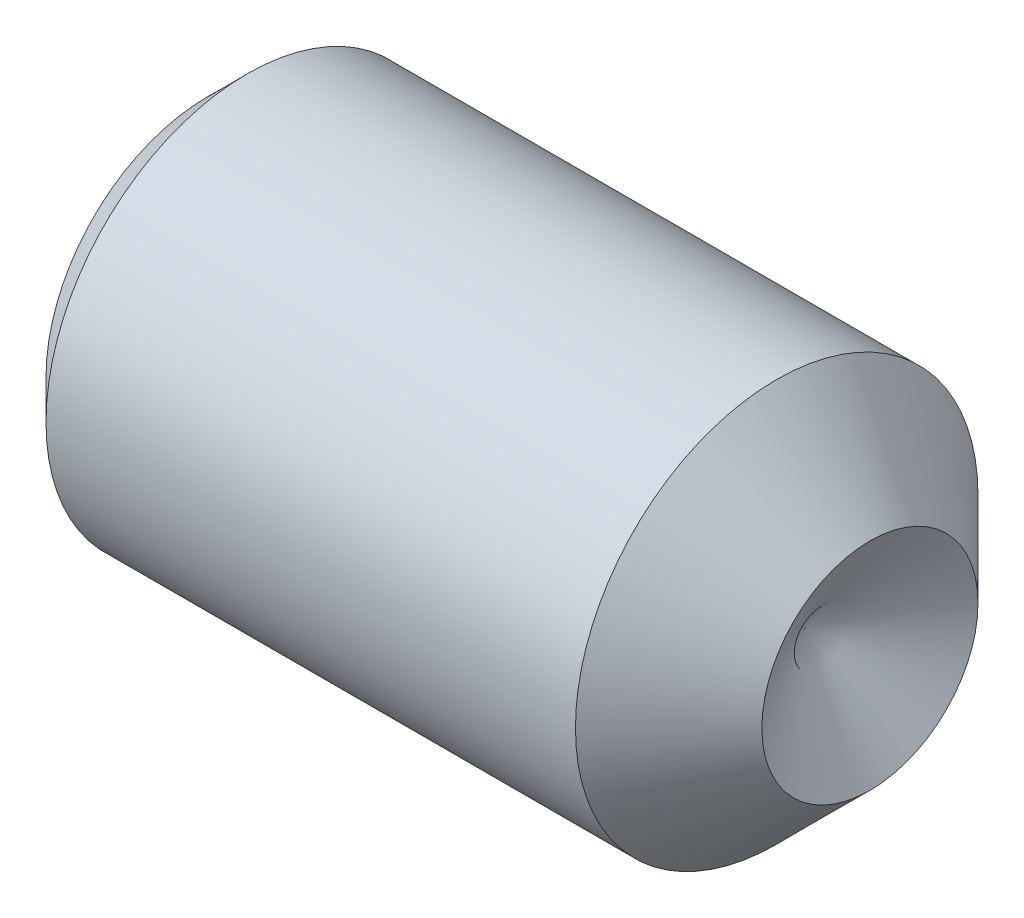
SolidWorks part; units mm, degrees
ref_plane "Plane1" through (0, 0, 0) normal (0, 0, 1) x (1, 0, 0)
ref_plane "Plane2" through (0, 0, 0) normal (0, 1, 0) x (1, 0, 0)
ref_plane "Plane3" through (0, 0, 0) normal (1, 0, 0) x (0, 0, -1)
revolve "BaseBody" add sketch "BodySke" angle 360 about L5
sketch "BodySke" plane through (0, 0, 0) normal (0, 0, 1) x (1, 0, 0)
  line L0 (0, 0) -> (0, 1.9406)
  line L1 (0, 1.9406) -> (0.4724, 2.413)
  line L2 (0.4724, 2.413) -> (6.8199, 2.413)
  line L3 (6.8199, 2.413) -> (7.9375, 1.2954)
  line L4 (7.1591, 0) -> (0, 0)
  line L5 (-12.7, 0) -> (88.9, 0) construction
  line L6 (7.1591, 0) -> (7.9375, 1.2954)
  line L7 (7.9375, 1.2954) -> (7.9375, 10.8204) construction
  line L8 (0, -1.9406) -> (0.4724, -2.413) construction
  line L9 (7.1591, 0) -> (7.9375, -1.2954) construction
  line L10 (6.8199, -2.413) -> (7.9375, -1.2954) construction
  line L11 (0.7925, 15.875) -> (0.7925, -3.175) construction
  dimension "Length" = 7.9375
  dimension "Diameter" = 4.826
  dimension "Drive_ch_ang" = 45
  dimension "Minor_dia" = 3.8811
  dimension "Cup_nose_ang" = 45
  dimension "Cup_ang" = 118
  dimension "Cup_dia" = 2.5908
  dimension "Advance" = 0.7925
sketch "Sketch2" plane through (0, 0, 0) normal (-1, 0, 0) x (0, 0, 1)
  line L0 (0.687, 1.19) -> (-0.687, 1.19)
  line L1 (-0.687, 1.19) -> (-1.3741, 0)
  line L2 (0.687, 1.19) -> (1.3741, 0)
  line L3 (0.687, -1.19) -> (1.3741, 0)
  line L4 (0.687, -1.19) -> (-0.687, -1.19)
  line L5 (-0.687, -1.19) -> (-1.3741, 0)
  dimension "Hex_size" = 2.38
  dimension "D2" = 1.19
  dimension "D3" = 1.19
extrude "Hex" cut sketch "Sketch2" against normal blind 2.54
sketch "Sketch4" plane through (0, 4.7709, -0.5249) normal (-1, 0, 0) x (0, 0, 1)
  line L0 (0.5249, -4.7709) -> (1.9854, -4.7709)
  line L1 (0.5249, -4.7709) -> (6.6732, -1.2211) construction
  line L2 (0.5249, -4.7709) -> (1.2551, -3.506)
  line L3 (1.7258, -4.4441) -> (1.9182, -4.333)
  line L4 (1.4083, -3.8942) -> (1.6007, -3.7831)
  arc A0 (1.7258, -4.4441) -> (1.4083, -3.8942) centre (0.5249, -4.7709) ccw
  arc A1 (1.9854, -4.7709) -> (1.9182, -4.333) centre (0.5249, -4.7709) ccw
  arc A2 (1.2551, -3.506) -> (1.6007, -3.7831) centre (0.5249, -4.7709) cw
  circle A3 centre (0.5249, -4.7709) radius 1.2446 construction
  circle A4 centre (0.5249, -4.7709) radius 1.4605 construction
  dimension "D1" = 30
  dimension "Spline_n_dim" = 2.4892
  dimension "Spline_m_dim" = 2.921
  dimension "Spline_a_dim" = 60
  dimension "D3" = 0.3175
  dimension "Spline_p_dim" = 0.635
extrude "Spline" [suppressed] cut sketch "Sketch4" against normal blind 2.032
pattern_circular "CirPattern1" [suppressed] count 6 every 60 about axis through (-12.7, 0, 0) along (1, 0, 0)
sketch "ThdSchSke" plane through (0, 0, 0) normal (0, 0, 1) x (1, 0, 0)
  line L0 (0.4724, -1.9406) -> (0.1416, -2.413)
  line L1 (0.4724, -1.9406) -> (0.8032, -2.413)
  line L2 (0.8032, -2.413) -> (0.8032, -3.0162)
  line L3 (-3.175, 0) -> (5.1513, 0) construction
  line L4 (0.4724, 2.413) -> (0.4724, -2.413) construction
  line L5 (0.8032, -3.0162) -> (0.1416, -3.0162)
  line L6 (0.1416, -3.0162) -> (0.1416, -2.413)
  dimension "Thread_minor" = 3.8811
  dimension "Diameter" = 4.826
  dimension "SideAngle" = 55
  dimension "VeeAngle" = 70
  dimension "Overcut" = 6.0325
revolve "ThreadSchematic" [suppressed] cut sketch "ThdSchSke" angle 360 about L3
pattern_linear "ThdSchPat" [suppressed]
equation "\"D2@Sketch2\" = \"Hex_size@Sketch2\" / 2"
equation "\"D3@Sketch2\" = \"Hex_size@Sketch2\" / 2"
equation "\"Thread_minor@ThreadCosmetic\" = \"Minor_dia@BodySke\""
equation "\"D1@Sketch4\" = \"Spline_a_dim@Sketch4\" / 2"
equation "\"D3@Sketch4\" = \"Spline_p_dim@Sketch4\" / 2"
equation "\"D2@CirPattern1\" = \"Spline_a_dim@Sketch4\""
equation "\"Num_teeth@CirPattern1\" = 360 / \"D2@CirPattern1\""
equation "\"Thread_minor@ThdSchSke\" = \"Thread_minor@ThreadCosmetic\""
equation "\"Diameter@ThdSchSke\" = \"Diameter@BodySke\""
equation "\"Overcut@ThdSchSke\" = \"Diameter@BodySke\" * 1.25"
equation "\"Num_threads@ThdSchPat\" = int( (\"Length@BodySke\" - ( ( ( \"Diameter@BodySke\" - \"Minor_dia@BodySke\" ) * 0.5 ) / tan( \"Drive_ch_ang@BodySke\" * 0.017453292 ) ) - ( ( ( \"Diameter@BodySke\" - \"Cup_dia@BodySk"
equation "\"Advance@ThdSchPat\" = (\"Length@BodySke\" - ( ( ( \"Diameter@BodySke\" - \"Minor_dia@BodySke\" ) * 0.5 ) / tan( \"Drive_ch_ang@BodySke\" * 0.017453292 ) ) - ( ( ( \"Diameter@BodySke\" - \"Cup_dia@BodySke\" ) * 0."
equation "' \"Num_threads@ThdSchPat\" = \"Num_threads@ThdSchPat\" - sgn( \"Num_threads@ThdSchPat\" - 1) '---chamfered tips only---"
